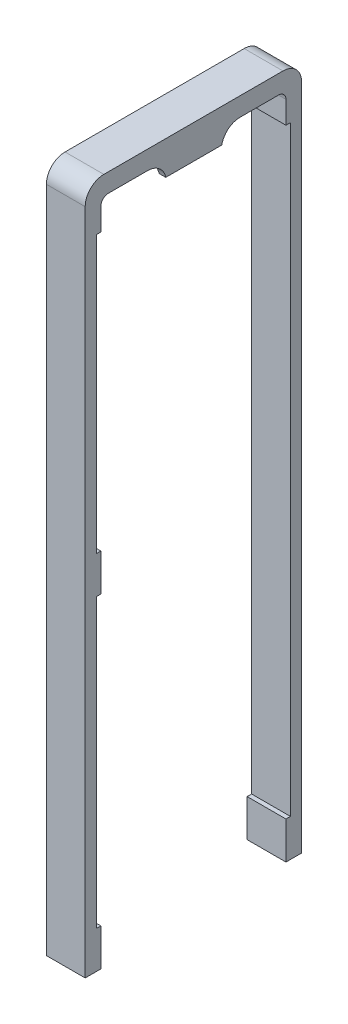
SolidWorks part; units mm, degrees
ref_plane "Front Plane" through (0, 0, 0) normal (0, 0, 1) x (1, 0, 0)
ref_plane "Top Plane" through (0, 0, 0) normal (0, 1, 0) x (1, 0, 0)
ref_plane "Right Plane" through (0, 0, 0) normal (1, 0, 0) x (0, 0, -1)
sketch "Sketch1" plane through (0, 0, 0) normal (0, 0, 1) x (1, 0, 0)
  line L1 (-39.6441, 81.7026) -> (-29.2441, 81.7026)
  line L2 (-39.6441, 81.7026) -> (-39.6441, -102.2974)
  line L3 (-39.6441, -102.2974) -> (-29.2441, -102.2974)
  line L4 (-29.2441, 81.7026) -> (-29.2441, -102.2974)
  dimension "D1" = 184
  dimension "D2" = 10.4
extrude "Boss-Extrude1" add sketch "Sketch1" along normal blind 4.2
ref_plane "Plane1" through (0, 0, 4.2) normal (0, 0, 1) x (1, 0, 0)
sketch "Sketch2" plane through (0, 0, 4.2) normal (0, 0, 1) x (1, 0, 0)
  line L0 (-29.2441, -102.2974) -> (-29.2441, 81.7026) construction
  line L1 (-39.6441, 81.7026) -> (-29.2441, 81.7026)
  line L2 (-39.6441, 81.7026) -> (-39.6441, 76.7026)
  line L3 (-39.6441, 76.7026) -> (-29.2441, 76.7026)
  line L4 (-29.2441, 81.7026) -> (-29.2441, 76.7026)
  dimension "D1" = 5
extrude "Boss-Extrude2" add sketch "Sketch2" along normal blind 49.6
ref_plane "Plane2" through (0, 0, 53.8) normal (0, 0, 1) x (1, 0, 0)
sketch "Sketch3" plane through (0, 0, 53.8) normal (0, 0, 1) x (1, 0, 0)
  line L1 (-39.6441, 81.7026) -> (-29.2441, 81.7026)
  line L2 (-39.6441, 81.7026) -> (-39.6441, -102.2974)
  line L3 (-39.6441, -102.2974) -> (-29.2441, -102.2974)
  line L4 (-29.2441, 81.7026) -> (-29.2441, -102.2974)
extrude "Boss-Extrude3" add sketch "Sketch3" along normal blind 4.2
ref_plane "Plane3" through (0, 76.7026, 0) normal (0, -1, 0) x (-1, 0, 0)
sketch "Sketch4" plane through (0, 76.7026, 0) normal (0, -1, 0) x (-1, 0, 0)
  line L0 (39.6441, -53.8) -> (39.6441, -4.2) construction
  line L1 (39.6441, -21.4) -> (29.2441, -21.4)
  line L2 (39.6441, -21.4) -> (39.6441, -36.4)
  line L3 (39.6441, -36.4) -> (29.2441, -36.4)
  line L4 (29.2441, -21.4) -> (29.2441, -36.4)
  line L5 (29.2441, -53.8) -> (29.2441, -4.2) construction
  line L6 (39.6441, -4.2) -> (29.2441, -4.2) construction
  dimension "D1" = 15
  dimension "D2" = 17.2
extrude "Boss-Extrude4" add sketch "Sketch4" along normal blind 2
ref_plane "Plane4" through (0, 74.7026, 0) normal (0, -1, 0) x (-1, 0, 0)
sketch "Sketch5" plane through (0, 74.7026, 0) normal (0, -1, 0) x (-1, 0, 0)
  line L0 (29.2441, -36.4) -> (39.6441, -36.4) construction
  line L1 (39.6441, -21.4) -> (37.8441, -21.4)
  line L2 (39.6441, -21.4) -> (39.6441, -36.4)
  line L3 (39.6441, -36.4) -> (37.8441, -36.4)
  line L4 (37.8441, -21.4) -> (37.8441, -36.4)
  line L6 (29.2441, -21.4) -> (31.0441, -21.4)
  line L7 (29.2441, -21.4) -> (29.2441, -36.4)
  line L8 (29.2441, -36.4) -> (31.0441, -36.4)
  line L9 (31.0441, -21.4) -> (31.0441, -36.4)
  dimension "D1" = 1.8
  dimension "D2" = 1.8
extrude "Boss-Extrude5" add sketch "Sketch5" along normal blind 2
fillet "Fillet1" radius 2 2 edges at (-34.4441, 76.7026, 4.2) (-34.4441, 76.7026, 53.8)
fillet "Fillet2" radius 5 2 edges at (-34.4441, 76.7026, 21.4) (-34.4441, 76.7026, 36.4)
fillet "Fillet3" radius 0.2 2 edges at (-37.8441, 74.7026, 28.9) (-31.0441, 74.7026, 28.9)
fillet "Fillet4" radius 5 2 edges at (-34.4441, 81.7026, 0) (-34.4441, 81.7026, 58)
ref_plane "Plane5" through (-39.6441, 0, 0) normal (-1, 0, 0) x (0, 0, 1)
sketch "Sketch6" plane through (-39.6441, 0, 0) normal (-1, 0, 0) x (0, 0, 1)
  line L0 (53.8, 74.7026) -> (53.8, -102.2974) construction
  line L1 (53.8, 68.7026) -> (55, 68.7026)
  line L2 (53.8, 68.7026) -> (53.8, -5.2974)
  line L3 (53.8, -5.2974) -> (55, -5.2974)
  line L4 (55, 68.7026) -> (55, -5.2974)
  line L5 (4.2, 74.7026) -> (4.2, -102.2974) construction
  line L6 (4.2, 68.7026) -> (3, 68.7026)
  line L7 (4.2, 68.7026) -> (4.2, -92.2974)
  line L8 (4.2, -92.2974) -> (3, -92.2974)
  line L9 (3, 68.7026) -> (3, -92.2974)
  line L10 (58, 76.7026) -> (58, -102.2974) construction
  line L11 (53.8, -15.2974) -> (55, -15.2974)
  line L12 (53.8, -15.2974) -> (53.8, -92.2974)
  line L13 (53.8, -92.2974) -> (55, -92.2974)
  line L14 (55, -15.2974) -> (55, -92.2974)
  line L15 (0, 76.7026) -> (0, -102.2974) construction
  line L16 (16.501, 76.7026) -> (6.2, 76.7026) construction
  line L17 (51.8, 76.7026) -> (41.299, 76.7026) construction
  line L18 (4.2, -102.2974) -> (0, -102.2974) construction
  line L19 (58, -102.2974) -> (53.8, -102.2974) construction
  dimension "D1" = 3
  dimension "D2" = 3
  dimension "D3" = 3
  dimension "D4" = 8
  dimension "D5" = 8
  dimension "D6" = 10
  dimension "D7" = 10
  dimension "D8" = 10
  dimension "D9" = 74
extrude "Cut-Extrude1" cut sketch "Sketch6" against normal blind 25
